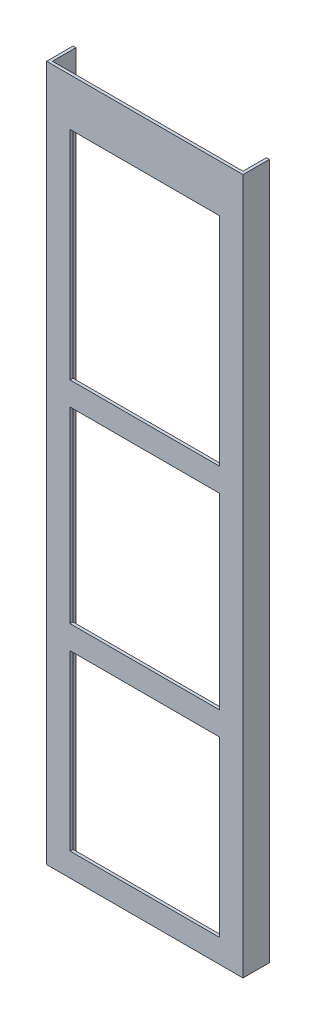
SolidWorks part; units mm, degrees
ref_plane "Front Plane" through (0, 0, 0) normal (0, 0, 1) x (1, 0, 0)
ref_plane "Top Plane" through (0, 0, 0) normal (0, 1, 0) x (1, 0, 0)
ref_plane "Right Plane" through (0, 0, 0) normal (1, 0, 0) x (0, 0, -1)
sketch "Sketch1" plane through (0, 0, 0) normal (0, 1, 0) x (1, 0, 0)
  line L0 (0, 50) -> (0, 41.5) construction
  line L1 (-50, 0) -> (-41.5, 0) construction
  line L2 (-50, 0) -> (-50, 50) construction
  line L3 (-50, 50) -> (50, 50) construction
  line L4 (50, 50) -> (50, -50) construction
  line L5 (50, -50) -> (-50, -50) construction
  line L6 (-50, -50) -> (-50, 0) construction
  line L7 (-41.5, 50) -> (-41.5, -50) construction
  line L8 (41.5, 50) -> (41.5, -50) construction
  line L9 (-50, 41.5) -> (50, 41.5) construction
  line L10 (-50, -41.5) -> (50, -41.5) construction
  line L11 (51.5875, 51.5875) -> (-51.5875, 51.5875)
  line L12 (50, 50) -> (-50, 50)
  line L13 (50, 50) -> (50, -50)
  line L14 (50, -50) -> (-50, -50)
  line L15 (-50, 50) -> (-50, -50)
  line L16 (-51.5875, 51.5875) -> (-51.5875, -51.5875)
  line L17 (51.5875, -51.5875) -> (-51.5875, -51.5875)
  line L18 (51.5875, 51.5875) -> (51.5875, -51.5875)
  line L47 (41.5, 0) -> (50, 0) construction
  line L52 (0, -41.5) -> (0, -50) construction
  circle A0 centre (0, 0) radius 76.2 construction
  dimension "D4" = 152.4
  dimension "D1" = 1.5875
extrude "BulkShellExtrude" add sketch "Sketch1" along normal blind 376.8
sketch "AirframeReferenceBottom" plane through (0, 0, 0) normal (0, 1, 0) x (1, 0, 0)
  circle A0 centre (0, 0) radius 76.2 construction
  dimension "D1" = 152.4
sketch "AxialReference" plane through (0, 0, 0) normal (1, 0, 0) x (0, 0, -1)
  line L0 (0, 0) -> (0, 376.8) construction
  line L1 (-51.5875, 376.8) -> (51.5875, 376.8) construction
sketch "AirframeReferenceTop" plane through (0, 376.8, 0) normal (0, 1, 0) x (1, 0, 0)
  circle A0 centre (0, 0) radius 76.2 construction
  dimension "D1" = 152.4
sketch "Sketch14" plane through (51.5875, 0, 0) normal (1, 0, 0) x (0, 0, -1)
  line L0 (-51.5875, 376.8) -> (-51.5875, 0) construction
  line L1 (-38.8875, 364.1) -> (38.8875, 364.1)
  line L2 (-38.8875, 364.1) -> (-38.8875, 12.7)
  line L3 (-38.8875, 12.7) -> (38.8875, 12.7)
  line L4 (38.8875, 364.1) -> (38.8875, 12.7)
  line L5 (51.5875, 376.8) -> (51.5875, 0) construction
  line L6 (76.2, 376.8) -> (-76.2, 376.8) construction
  line L7 (76.2, 0) -> (-76.2, 0) construction
  dimension "D1" = 12.7
  dimension "D2" = 12.7
  dimension "D3" = 12.7
  dimension "D4" = 12.7
extrude "SideWallCut" cut sketch "Sketch14" against normal blind 103.1875
sketch "Sketch22" plane through (51.5875, 0, 0) normal (1, 0, 0) x (0, 0, -1)
  line L0 (76.2, 0) -> (-76.2, 0) construction
  line L1 (-51.5875, 376.8) -> (-50, 376.8) construction
  line L2 (-51.5875, 376.8) -> (-51.5875, 0) construction
  line L3 (-51.5875, 0) -> (-50, 0) construction
  line L4 (-50, 376.8) -> (-50, 0) construction
  line L5 (76.2, 376.8) -> (-76.2, 376.8) construction
  line L6 (51.5875, 0) -> (50, 0) construction
  line L7 (51.5875, 0) -> (51.5875, 376.8) construction
  line L8 (51.5875, 376.8) -> (50, 376.8) construction
  line L9 (50, 0) -> (50, 376.8) construction
  line L11 (-50, 376.8) -> (50, 376.8)
  line L12 (-50, 376.8) -> (-50, 0)
  line L13 (-50, 0) -> (50, 0)
  line L14 (50, 376.8) -> (50, 0)
  dimension "D1" = 1.5875
  dimension "D2" = 1.5875
extrude "Cut-Extrude4" cut sketch "Sketch22" against normal blind 103.1875
sketch "Sketch23" plane through (51.5875, 0, 0) normal (1, 0, 0) x (0, 0, -1)
  line L1 (-51.5875, 376.8) -> (-50, 376.8)
  line L2 (-51.5875, 376.8) -> (-51.5875, 0)
  line L3 (-51.5875, 0) -> (-50, 0)
  line L4 (-50, 376.8) -> (-50, 0)
extrude "Boss-Extrude1" add sketch "Sketch23" along normal blind 1.5875
mirror "Mirror1" about plane through (0, 0, 0) normal (1, 0, 0) of "Boss-Extrude1"
sketch "Sketch24" plane through (0, 0, 50) normal (0, 0, -1) x (-1, 0, 0)
  line L0 (76.2, 0) -> (-76.2, 0) construction
  line L1 (-53.175, 376.8) -> (-51.5875, 376.8)
  line L2 (-53.175, 376.8) -> (-53.175, 0)
  line L3 (-53.175, 0) -> (-51.5875, 0)
  line L4 (-51.5875, 376.8) -> (-51.5875, 0)
  line L6 (53.175, 376.8) -> (51.5875, 376.8)
  line L7 (53.175, 376.8) -> (53.175, 0)
  line L8 (53.175, 0) -> (51.5875, 0)
  line L9 (51.5875, 376.8) -> (51.5875, 0)
  dimension "D1" = 1.5875
  dimension "D2" = 1.5875
extrude "Boss-Extrude2" add sketch "Sketch24" along normal blind 12.7
sketch "Sketch25" plane through (0, 0, 51.5875) normal (0, 0, 1) x (1, 0, 0)
  line L0 (0, 0) -> (0, 376.8) construction
  line L1 (40.475, 12.7) -> (-40.475, 12.7)
  line L2 (40.475, 12.7) -> (40.475, 364.1)
  line L3 (40.475, 364.1) -> (-40.475, 364.1)
  line L4 (-40.475, 12.7) -> (-40.475, 364.1)
  line L5 (40.475, 12.7) -> (-40.475, 364.1) construction
  line L6 (40.475, 364.1) -> (-40.475, 12.7) construction
  line L7 (-53.175, 376.8) -> (-53.175, 0) construction
  line L8 (76.2, 376.8) -> (-76.2, 376.8) construction
  point P0 (0, 188.4)
  dimension "D1" = 12.7
  dimension "D2" = 12.7
extrude "Cut-Extrude5" cut sketch "Sketch25" against normal blind 2.54
sketch "Sketch26" plane through (0, 0, 51.5875) normal (0, 0, 1) x (1, 0, 0)
  line L0 (0, 0) -> (0, 376.8) construction
  line L1 (76.2, 376.8) -> (-76.2, 376.8) construction
  line L2 (-53.175, 113.03) -> (53.175, 113.03) construction
  line L3 (-53.175, 376.8) -> (-53.175, 0) construction
  line L4 (53.175, 376.8) -> (53.175, 0) construction
  line L5 (76.2, 0) -> (-76.2, 0) construction
  line L6 (-53.175, 227.33) -> (53.175, 227.33) construction
  line L7 (-53.175, 220.98) -> (53.175, 220.98)
  line L8 (-53.175, 106.68) -> (53.175, 106.68)
  line L9 (-53.175, 233.68) -> (53.175, 233.68)
  line L10 (-53.175, 119.38) -> (53.175, 119.38)
  line L11 (-53.175, 351.155) -> (53.175, 351.155) construction
  line L12 (40.475, 12.7) -> (-40.475, 12.7)
  line L13 (40.475, 12.7) -> (40.475, 364.1)
  line L14 (40.475, 364.1) -> (-40.475, 364.1)
  line L15 (-40.475, 12.7) -> (-40.475, 364.1)
  line L16 (40.475, 12.7) -> (-40.475, 364.1) construction
  line L17 (40.475, 364.1) -> (-40.475, 12.7) construction
  line L19 (-40.475, 351.155) -> (40.475, 351.155)
  line L20 (-40.475, 351.155) -> (-40.475, 364.1)
  line L21 (-40.475, 364.1) -> (40.475, 364.1)
  line L22 (40.475, 351.155) -> (40.475, 364.1)
  point P23 (0, 188.4)
  dimension "D1" = 113.03
  dimension "D2" = 227.33
  dimension "D5" = 351.155
  dimension "D3" = 6.35
  dimension "D4" = 6.35
extrude "Boss-Extrude3" add sketch "Sketch26" against normal blind 1.5875 contours L15 L19 M7 M6 | L9 L7 M5 M7 | L10 L8 M5 M7
